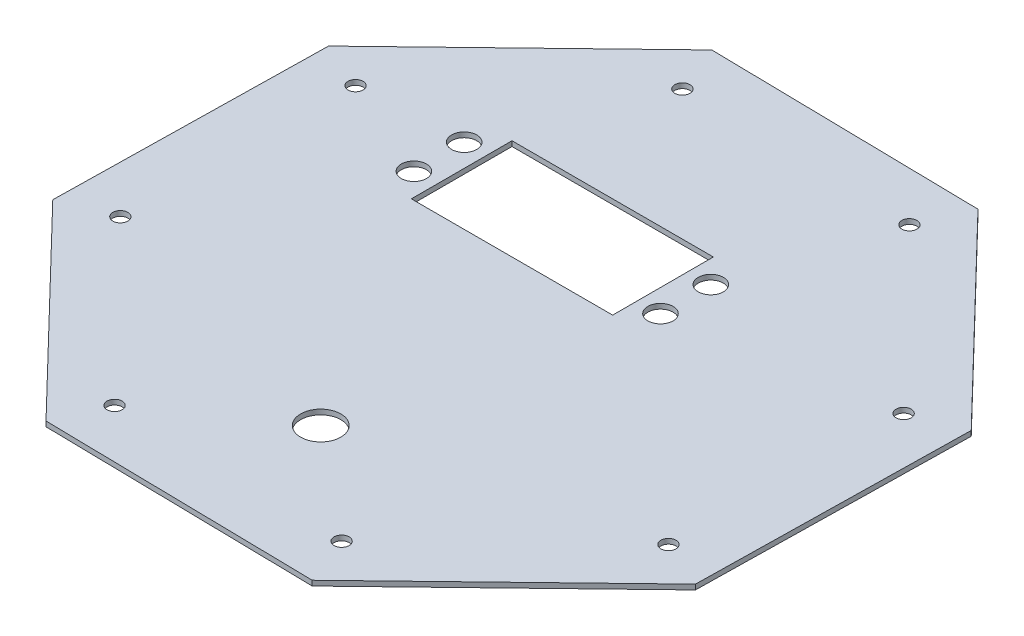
SolidWorks part; units mm, degrees
ref_plane "Front Plane" through (0, 0, 0) normal (0, 0, 1) x (1, 0, 0)
ref_plane "Top Plane" through (0, 0, 0) normal (0, 1, 0) x (1, 0, 0)
ref_plane "Right Plane" through (0, 0, 0) normal (1, 0, 0) x (0, 0, -1)
sketch "Sketch1" plane through (0, 0, 0) normal (0, 1, 0) x (1, 0, 0)
  line L0 (0, 0) -> (25.7702, -65.466) construction
  line L1 (25.7702, -65.466) -> (64.5137, -28.0691)
  line L2 (64.5137, -28.0691) -> (65.466, 25.7702)
  line L3 (65.466, 25.7702) -> (28.0691, 64.5137)
  line L4 (28.0691, 64.5137) -> (-25.7702, 65.466)
  line L5 (-25.7702, 65.466) -> (-64.5137, 28.0691)
  line L6 (-64.5137, 28.0691) -> (-65.466, -25.7702)
  line L7 (-65.466, -25.7702) -> (-28.0691, -64.5137)
  line L8 (-28.0691, -64.5137) -> (25.7702, -65.466)
  line L9 (0, 0) -> (64.5137, -28.0691) construction
  line L10 (0, 0) -> (65.466, 25.7702) construction
  line L11 (0, 0) -> (28.0691, 64.5137) construction
  line L12 (0, 0) -> (-25.7702, 65.466) construction
  line L13 (0, 0) -> (-64.5137, 28.0691) construction
  line L14 (0, 0) -> (-65.466, -25.7702) construction
  line L15 (0, 0) -> (-28.0691, -64.5137) construction
  line L16 (0, 0) -> (21.9771, -55.8301) construction
  line L17 (21.9771, -55.8301) -> (0, 0) construction
  line L18 (0, 0) -> (55.0181, -23.9377) construction
  line L19 (55.0181, -23.9377) -> (0, 0) construction
  line L20 (0, 0) -> (55.8301, 21.9771) construction
  line L21 (55.8301, 21.9771) -> (0, 0) construction
  line L22 (0, 0) -> (23.9377, 55.0181) construction
  line L23 (23.9377, 55.0181) -> (0, 0) construction
  line L24 (0, 0) -> (-21.9771, 55.8301) construction
  line L25 (-21.9771, 55.8301) -> (0, 0) construction
  line L26 (0, 0) -> (-55.0181, 23.9377) construction
  line L27 (-55.0181, 23.9377) -> (0, 0) construction
  line L28 (0, 0) -> (-55.8301, -21.9771) construction
  line L29 (-52.2083, -20.5514) -> (-52.2405, -21.1382) construction
  line L30 (-55.8301, -21.9771) -> (0, 0) construction
  line L31 (0, 0) -> (-23.9377, -55.0181) construction
  circle A0 centre (0, 0) radius 65 construction
  circle A1 centre (-55.8301, -21.9771) radius 1.5
  circle A2 centre (-55.0181, 23.9377) radius 1.5
  circle A3 centre (-21.9771, 55.8301) radius 1.5
  circle A4 centre (23.9377, 55.0181) radius 1.5
  circle A5 centre (55.8301, 21.9771) radius 1.5
  circle A6 centre (55.0181, -23.9377) radius 1.5
  circle A7 centre (21.9771, -55.8301) radius 1.5
  circle A8 centre (-23.9377, -55.0181) radius 1.5
extrude "Boss-Extrude1" add sketch "Sketch1" along normal blind 1
sketch "Sketch2" plane through (0, 1, 0) normal (0, 1, 0) x (1, 0, 0)
  line L0 (10, 10) -> (14.5, 10) construction
  line L1 (14.5, 10) -> (14.5, 30) construction
  line L2 (14.5, 30) -> (10, 30) construction
  line L3 (10, 20) -> (10, 30) construction
  line L4 (10, 20) -> (10, 10) construction
  line L5 (10, 10) -> (-30, 10) construction
  line L6 (-30, 10) -> (-30, 30) construction
  line L7 (-30, 30) -> (10, 30) construction
  line L8 (14.5, 10) -> (14.5, 15) construction
  line L9 (-30, 10) -> (10, 10)
  line L10 (-30, 10) -> (-30, 30)
  line L11 (-30, 30) -> (10, 30)
  line L12 (10, 10) -> (10, 30)
  line L13 (14.5, 15) -> (14.5, 25) construction
  line L14 (-30, 10) -> (-34.5, 10) construction
  line L15 (-34.5, 10) -> (-34.5, 30) construction
  line L16 (-34.5, 30) -> (-34.5, 25) construction
  line L17 (-34.5, 25) -> (-34.5, 15) construction
  line L18 (-34.5, 10) -> (-30, 10) construction
  line L19 (-34.5, 10) -> (-34.5, 15) construction
  line L20 (0, 10) -> (0, -38) construction
  circle A2 centre (0, -38) radius 4
  circle A3 centre (14.5, 15) radius 2.5
  circle A4 centre (14.5, 25) radius 2.5
  circle A5 centre (-34.5, 15) radius 2.5
  circle A6 centre (-34.5, 25) radius 2.5
  point P21 (0, 0)
extrude "Cut-Extrude1" cut sketch "Sketch2" against normal blind 10
